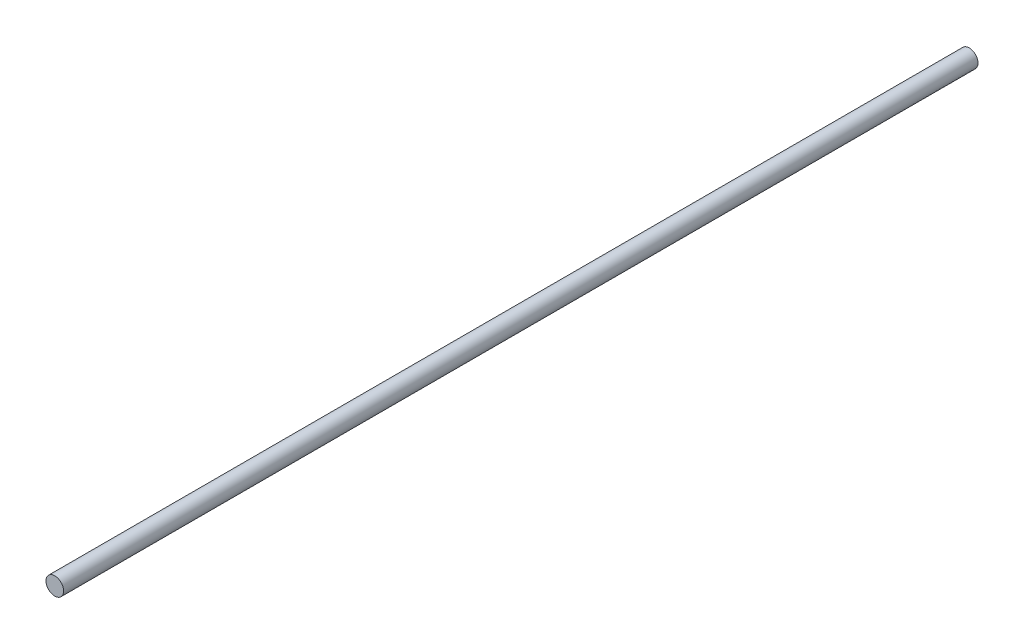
SolidWorks part; units mm, degrees
ref_plane "前视基准面" through (0, 0, 0) normal (0, 0, 1) x (1, 0, 0)
ref_plane "上视基准面" through (0, 0, 0) normal (0, 1, 0) x (1, 0, 0)
ref_plane "右视基准面" through (0, 0, 0) normal (1, 0, 0) x (0, 0, -1)
other "Configuration Table"
sketch "草图1" plane through (0, 0, 0) normal (0, 0, 1) x (1, 0, 0)
  circle A0 centre (0, 0) radius 4
  dimension "D1" = 8
extrude "Screw_Envelope_D8_Length390_NoThread" add sketch "草图1" against normal mid plane 415
